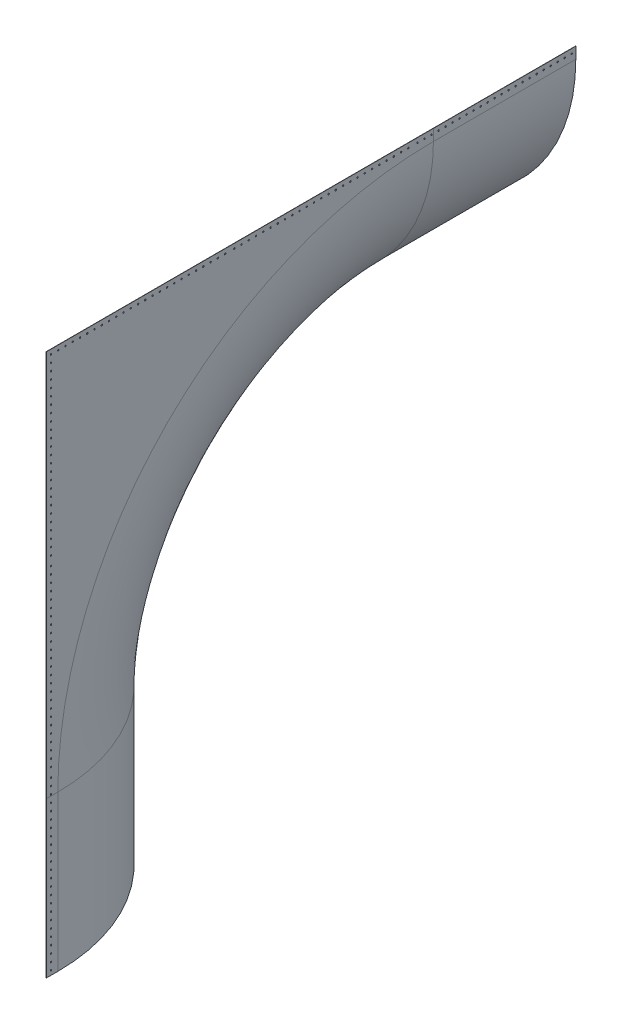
SolidWorks part; units mm, degrees
ref_plane "Front Plane" through (0, 0, 0) normal (1, 0, 0) x (0, 1, 0)
ref_plane "Top Plane" through (0, 0, 0) normal (0, 0, 1) x (0, 1, 0)
ref_plane "Right Plane" through (0, 0, 0) normal (0, 1, 0) x (-1, 0, 0)
sketch "sk 48.2in rad pnl" plane through (0, 0, 0) normal (0, 0, 1) x (0, 1, 0)
  line B0 (0, -1222.6925) -> (75.7466, -1222.6925)
  line B1 (-1222.6925, 75.7378) -> (-1222.6925, 0)
  line B2 (-1224.28, 75.7378) -> (-1224.28, 0)
  line B3 (-1224.28, 75.7378) -> (-1222.6925, 75.7378)
  line B4 (75.7466, -1222.6925) -> (75.7466, -1224.28)
  line B5 (0, -1224.28) -> (75.7466, -1224.28)
  arc B6 (0, -1224.28) -> (-1224.28, 0) centre (0, 0) cw
  arc B7 (0, -1222.6925) -> (-1222.6925, 0) centre (0, 0) cw
sketch_block_instance "48.2in rad pnl-1"
sketch_block "48.2in rad pnl" parameters "D1"=1224.28
sketch "Corner Arch" plane through (0, 0, 0) normal (1, 0, 0) x (0, 1, 0)
  line L0 (0, 75.7422) -> (0, 0)
  line L1 (-2498.8, 2574.5422) -> (-2574.5422, 2574.5422)
  arc A0 (-2498.8, 2574.5422) -> (0, 75.7422) centre (-2498.8, 75.7422) cw
  dimension "D3" = 2498.8
  dimension "D1" = 75.7422
  dimension "D2" = 75.7422
sweep "Sweep2" add profiles "sk 48.2in rad pnl" path "Corner Arch"
sketch "Lower profile" plane through (0, 0, 0) normal (0, 0, -1) x (1, 0, 0)
  line L0 (-75.7378, 1224.28) -> (0, 1224.28)
  line L1 (1224.28, -75.7466) -> (1224.28, 0)
  line L3 (1222.6925, -75.7466) -> (1222.6925, 0)
  line L4 (-75.7378, 1222.6925) -> (0, 1222.6925)
  line L5 (1222.6925, -75.7466) -> (1224.28, -75.7466)
  line L6 (-75.7378, 1224.28) -> (-75.7378, 1222.6925)
  line L7 (1224.28, 0) -> (1224.28, -75.7466) construction
  arc A0 (0, 1224.28) -> (1224.28, 0) centre (0, 0) cw
  arc A1 (1224.28, 0) -> (0, 1224.28) centre (0, 0) ccw construction
  arc A2 (0, 1222.6925) -> (1222.6925, 0) centre (0, 0) cw
  dimension "D1" = 1.5875
extrude "Boss-Extrude1" add sketch "Lower profile" along normal blind 920.7378
sketch "Sketch9" plane through (1224.28, 0, 0) normal (1, 0, 0) x (0, 1, 0)
  line L0 (75.7466, 75.7422) -> (75.7466, 2650.2888)
  line L2 (-2498.8, 2650.2888) -> (75.7466, 2650.2888)
  arc A0 (-2498.8, 2650.2888) -> (75.7466, 75.7422) centre (-2498.8, 75.7422) cw
  arc A1 (75.7466, 75.7422) -> (-2498.8, 2650.2888) centre (-2498.8, 75.7422) ccw construction
extrude "Boss-Extrude2" add sketch "Sketch9" against normal blind 1.5875
sketch "Sketch10" plane through (-75.7378, 0, 0) normal (-1, 0, 0) x (0, -1, 0)
  line B0 (2574.5422, 1350.2622) -> (2498.8, 1350.2622)
  line B1 (1224.28, 75.7422) -> (1224.28, -920.7378)
  line B2 (2574.5422, 1351.8497) -> (2498.8, 1351.8497)
  line B3 (1222.6925, 75.7422) -> (1222.6925, -920.7378)
  line B4 (1222.6925, -920.7378) -> (1224.28, -920.7378)
  line B5 (2574.5422, 1351.8497) -> (2574.5422, 1350.2622)
  arc B6 (2498.8, 1350.2622) -> (1224.28, 75.7422) centre (2498.8, 75.7422) ccw
  arc B7 (2498.8, 1351.8497) -> (1222.6925, 75.7422) centre (2498.8, 75.7422) ccw
sketch_block_instance "Radi Intersect-1"
sketch_block "Radi Intersect"
sketch "Sketch12" plane through (0, -2574.5422, 0) normal (0, -1, 0) x (1, 0, 0)
  line L0 (1224.28, 2650.2888) -> (1224.28, 2574.5422)
  line L1 (0, 1350.2622) -> (-75.7378, 1350.2622)
  line L2 (1222.6925, 2650.2888) -> (1222.6925, 2574.5422)
  line L3 (0, 1351.8497) -> (-75.7378, 1351.8497)
  line L4 (-75.7378, 1351.8497) -> (-75.7378, 1350.2622)
  line L5 (1222.6925, 2650.2888) -> (1224.28, 2650.2888)
  arc A0 (1224.28, 2574.5422) -> (0, 1350.2622) centre (0, 2574.5422) cw
  arc A1 (0, 1350.2622) -> (1224.28, 2574.5422) centre (0, 2574.5422) ccw construction
  arc A2 (1222.6925, 2574.5422) -> (0, 1351.8497) centre (0, 2574.5422) cw
  dimension "D1" = 1.5875
extrude "Boss-Extrude3" add sketch "Sketch12" along normal blind 1006.96
sketch "Sketch11" plane through (1224.28, 0, 0) normal (1, 0, 0) x (0, 1, 0)
  line L0 (75.7466, -920.7378) -> (0, -920.7378) construction
  line L1 (75.7466, -920.7378) -> (75.7466, 75.7422) construction
  circle A0 centre (45.4444, -890.4356) radius 4.826
  circle A1 centre (45.4444, -843.8184) radius 4.826
  circle A2 centre (45.4444, -797.2012) radius 4.826
  circle A3 centre (45.4444, -750.584) radius 4.826
  circle A4 centre (45.4444, -703.9668) radius 4.826
  circle A5 centre (45.4444, -657.3496) radius 4.826
  circle A6 centre (45.4444, -610.7324) radius 4.826
  circle A7 centre (45.4444, -564.1152) radius 4.826
  circle A8 centre (45.4444, -517.498) radius 4.826
  circle A9 centre (45.4444, -470.8808) radius 4.826
  circle A10 centre (45.4444, -424.2636) radius 4.826
  circle A11 centre (45.4444, -377.6464) radius 4.826
  circle A12 centre (45.4444, -331.0292) radius 4.826
  circle A13 centre (45.4444, -284.412) radius 4.826
  circle A14 centre (45.4444, -237.7948) radius 4.826
  circle A15 centre (45.4444, -191.1776) radius 4.826
  circle A16 centre (45.4444, -144.5604) radius 4.826
  circle A17 centre (45.4444, -97.9432) radius 4.826
  circle A18 centre (45.4444, -51.326) radius 4.826
  circle A19 centre (45.4444, -4.7088) radius 4.826
  circle A20 centre (45.4444, 41.9084) radius 4.826
  circle A21 centre (45.4444, 88.5256) radius 4.826
  circle A22 centre (45.4444, 135.1428) radius 4.826
  circle A23 centre (45.4444, 181.76) radius 4.826
  circle A24 centre (45.4444, 242.72) radius 4.826
  circle A25 centre (45.4444, 290.98) radius 4.826
  circle A26 centre (45.4444, 339.24) radius 4.826
  circle A27 centre (45.4444, 387.5) radius 4.826
  circle A28 centre (45.4444, 435.76) radius 4.826
  circle A29 centre (45.4444, 484.02) radius 4.826
  circle A30 centre (45.4444, 532.28) radius 4.826
  circle A31 centre (45.4444, 580.54) radius 4.826
  circle A32 centre (45.4444, 628.8) radius 4.826
  circle A33 centre (45.4444, 677.06) radius 4.826
  circle A34 centre (45.4444, 725.32) radius 4.826
  circle A35 centre (45.4444, 773.58) radius 4.826
  circle A36 centre (45.4444, 821.84) radius 4.826
  circle A37 centre (45.4444, 870.1) radius 4.826
  circle A38 centre (45.4444, 918.36) radius 4.826
  circle A39 centre (45.4444, 966.62) radius 4.826
  circle A40 centre (45.4444, 1014.88) radius 4.826
  circle A41 centre (45.4444, 1063.14) radius 4.826
  circle A42 centre (45.4444, 1111.4) radius 4.826
  circle A43 centre (45.4444, 1159.66) radius 4.826
  circle A44 centre (45.4444, 1207.92) radius 4.826
  circle A45 centre (45.4444, 1256.18) radius 4.826
  circle A46 centre (45.4444, 1304.44) radius 4.826
  circle A47 centre (45.4444, 1352.7) radius 4.826
  circle A48 centre (45.4444, 1400.96) radius 4.826
  circle A49 centre (45.4444, 1461.7422) radius 4.826
  circle A50 centre (45.4444, 1510.0022) radius 4.826
  circle A51 centre (45.4444, 1558.2622) radius 4.826
  circle A52 centre (45.4444, 1606.5222) radius 4.826
  circle A53 centre (45.4444, 1654.7822) radius 4.826
  circle A54 centre (45.4444, 1703.0422) radius 4.826
  circle A55 centre (45.4444, 1751.3022) radius 4.826
  circle A56 centre (45.4444, 1799.5622) radius 4.826
  circle A57 centre (45.4444, 1847.8222) radius 4.826
  circle A58 centre (45.4444, 1896.0822) radius 4.826
  circle A59 centre (45.4444, 1944.3422) radius 4.826
  circle A60 centre (45.4444, 1992.6022) radius 4.826
  circle A61 centre (45.4444, 2040.8622) radius 4.826
  circle A62 centre (45.4444, 2089.1222) radius 4.826
  circle A63 centre (45.4444, 2137.3822) radius 4.826
  circle A64 centre (45.4444, 2185.6422) radius 4.826
  circle A65 centre (45.4444, 2233.9022) radius 4.826
  circle A66 centre (45.4444, 2282.1622) radius 4.826
  circle A67 centre (45.4444, 2330.4222) radius 4.826
  circle A68 centre (45.4444, 2378.6822) radius 4.826
  circle A69 centre (45.4444, 2426.9422) radius 4.826
  circle A70 centre (45.4444, 2475.2022) radius 4.826
  circle A71 centre (45.4444, 2523.4622) radius 4.826
  circle A72 centre (45.4444, 2571.7222) radius 4.826
  circle A73 centre (45.4444, 2619.9822) radius 4.826
  circle A74 centre (-2.82, 2619.9822) radius 4.826
  circle A75 centre (-51.08, 2619.9822) radius 4.826
  circle A76 centre (-99.34, 2619.9822) radius 4.826
  circle A77 centre (-147.6, 2619.9822) radius 4.826
  circle A78 centre (-195.86, 2619.9822) radius 4.826
  circle A79 centre (-244.12, 2619.9822) radius 4.826
  circle A80 centre (-292.38, 2619.9822) radius 4.826
  circle A81 centre (-340.64, 2619.9822) radius 4.826
  circle A82 centre (-388.9, 2619.9822) radius 4.826
  circle A83 centre (-437.16, 2619.9822) radius 4.826
  circle A84 centre (-485.42, 2619.9822) radius 4.826
  circle A85 centre (-533.68, 2619.9822) radius 4.826
  circle A86 centre (-581.94, 2619.9822) radius 4.826
  circle A87 centre (-630.2, 2619.9822) radius 4.826
  circle A88 centre (-678.46, 2619.9822) radius 4.826
  circle A89 centre (-726.72, 2619.9822) radius 4.826
  circle A90 centre (-774.98, 2619.9822) radius 4.826
  circle A91 centre (-823.24, 2619.9822) radius 4.826
  circle A92 centre (-871.5, 2619.9822) radius 4.826
  circle A93 centre (-919.76, 2619.9822) radius 4.826
  circle A94 centre (-968.02, 2619.9822) radius 4.826
  circle A95 centre (-1016.28, 2619.9822) radius 4.826
  circle A96 centre (-1064.54, 2619.9822) radius 4.826
  circle A97 centre (-1112.8, 2619.9822) radius 4.826
  circle A99 centre (-1173.76, 2619.9822) radius 4.826
  circle A100 centre (-1222.02, 2619.9822) radius 4.826
  circle A101 centre (-1270.28, 2619.9822) radius 4.826
  circle A102 centre (-1318.54, 2619.9822) radius 4.826
  circle A103 centre (-1366.8, 2619.9822) radius 4.826
  circle A104 centre (-1415.06, 2619.9822) radius 4.826
  circle A105 centre (-1463.32, 2619.9822) radius 4.826
  circle A106 centre (-1511.58, 2619.9822) radius 4.826
  circle A107 centre (-1559.84, 2619.9822) radius 4.826
  circle A108 centre (-1608.1, 2619.9822) radius 4.826
  circle A109 centre (-1656.36, 2619.9822) radius 4.826
  circle A110 centre (-1704.62, 2619.9822) radius 4.826
  circle A111 centre (-1752.88, 2619.9822) radius 4.826
  circle A112 centre (-1801.14, 2619.9822) radius 4.826
  circle A113 centre (-1849.4, 2619.9822) radius 4.826
  circle A114 centre (-1897.66, 2619.9822) radius 4.826
  circle A115 centre (-1945.92, 2619.9822) radius 4.826
  circle A116 centre (-1994.18, 2619.9822) radius 4.826
  circle A117 centre (-2042.44, 2619.9822) radius 4.826
  circle A118 centre (-2090.7, 2619.9822) radius 4.826
  circle A119 centre (-2138.96, 2619.9822) radius 4.826
  circle A120 centre (-2187.22, 2619.9822) radius 4.826
  circle A121 centre (-2235.48, 2619.9822) radius 4.826
  circle A122 centre (-2283.74, 2619.9822) radius 4.826
  circle A123 centre (-2332, 2619.9822) radius 4.826
  circle A124 centre (-2392.96, 2619.9822) radius 4.826
  circle A125 centre (-2441.22, 2619.9822) radius 4.826
  circle A126 centre (-2489.48, 2619.9822) radius 4.826
  circle A127 centre (-2537.74, 2619.9822) radius 4.826
  circle A128 centre (-2586, 2619.9822) radius 4.826
  circle A129 centre (-2634.26, 2619.9822) radius 4.826
  circle A130 centre (-2682.52, 2619.9822) radius 4.826
  circle A131 centre (-2730.78, 2619.9822) radius 4.826
  circle A132 centre (-2779.04, 2619.9822) radius 4.826
  circle A133 centre (-2827.3, 2619.9822) radius 4.826
  circle A134 centre (-2875.56, 2619.9822) radius 4.826
  circle A135 centre (-2923.82, 2619.9822) radius 4.826
  circle A136 centre (-2972.08, 2619.9822) radius 4.826
  circle A137 centre (-3020.34, 2619.9822) radius 4.826
  circle A138 centre (-3068.6, 2619.9822) radius 4.826
  circle A139 centre (-3116.86, 2619.9822) radius 4.826
  circle A140 centre (-3165.12, 2619.9822) radius 4.826
  circle A141 centre (-3213.38, 2619.9822) radius 4.826
  circle A142 centre (-3261.64, 2619.9822) radius 4.826
  circle A143 centre (-3309.9, 2619.9822) radius 4.826
  circle A144 centre (-3358.16, 2619.9822) radius 4.826
  circle A145 centre (-3406.42, 2619.9822) radius 4.826
  circle A146 centre (-3454.68, 2619.9822) radius 4.826
  circle A147 centre (-3502.94, 2619.9822) radius 4.826
  circle A148 centre (-3551.2, 2619.9822) radius 4.826
  dimension "D2" = 9.652
  dimension "D6" = 9.652
  dimension "D9" = 9.652
  dimension "D12" = 9.652
  dimension "D15" = 9.652
  dimension "D18" = 9.652
  dimension "D1" = 30.3022
  dimension "D3" = 30.3022
  dimension "D5" = 60.96
  dimension "D8" = 60.7822
  dimension "D11" = 48.2644
  dimension "D14" = 60.96
  dimension "D17" = 60.96
  dimension "D4" = 24
  dimension "D7" = 25
  dimension "D10" = 25
  dimension "D13" = 24
  dimension "D16" = 25
  dimension "D19" = 25
extrude "Cut-Extrude1" cut sketch "Sketch11" against normal blind 10
sketch "Sketch13" plane through (0, 0, 0) normal (1, 0, 0) x (0, 1, 0)
  line L1 (-4091.7296, 1838.796) -> (309.4003, 1838.796)
  line L2 (-4091.7296, 1838.796) -> (-4091.7296, -1107.3155)
  line L3 (-4091.7296, -1107.3155) -> (309.4003, -1107.3155)
  line L4 (309.4003, 1838.796) -> (309.4003, -1107.3155)
extrude "Cut-Extrude2" cut sketch "Sketch13" against normal through all
sketch "Sketch14" plane through (0, 0, 0) normal (1, 0, 0) x (0, 1, 0)
  line L0 (-3958.437, 2838.1493) -> (-3532.15, 2838.1493)
  line L1 (-3532.15, 2838.1493) -> (-3532.15, -871.3856)
  line L2 (-3532.15, -871.3856) -> (231.6155, -871.3856)
  line L3 (231.6155, -871.3856) -> (231.6155, -1092.6574)
  line L4 (231.6155, -1092.6574) -> (-3958.437, -1092.6574)
  line L5 (-3958.437, -1092.6574) -> (-3958.437, 2838.1493)
  line L6 (-3581.5022, 2574.5422) -> (-3581.5022, 1350.2622) construction
  line L7 (75.7466, -920.7378) -> (0, -920.7378) construction
  dimension "D1" = 49.3522
  dimension "D2" = 49.3522
extrude "Cut-Extrude3" cut sketch "Sketch14" along normal through all both and the other way through all
sketch "Sketch15" plane through (0, 0, 0) normal (1, 0, 0) x (0, 1, 0)
  line L0 (-2500.15, 2867.3945) -> (-2500.15, 74.3922)
  line L1 (-2500.15, 74.3922) -> (744.4396, 74.3922)
  line L2 (744.4396, 74.3922) -> (744.4396, 25.04)
  line L3 (744.4396, 25.04) -> (-2549.5022, 25.04)
  line L4 (-2549.5022, 25.04) -> (-2549.5022, 2867.3945)
  line L5 (-2549.5022, 2867.3945) -> (-2500.15, 2867.3945)
  line L6 (-2498.8, 2574.5422) -> (-2498.8, 2650.2888) construction
  line L7 (0, 75.7422) -> (75.7466, 75.7422) construction
  dimension "D1" = 1.35
  dimension "D2" = 1.35
  dimension "D3" = 49.3522
  dimension "D4" = 49.3522
extrude "Cut-Extrude4" [suppressed] cut sketch "Sketch15" along normal through all both and the other way through all
